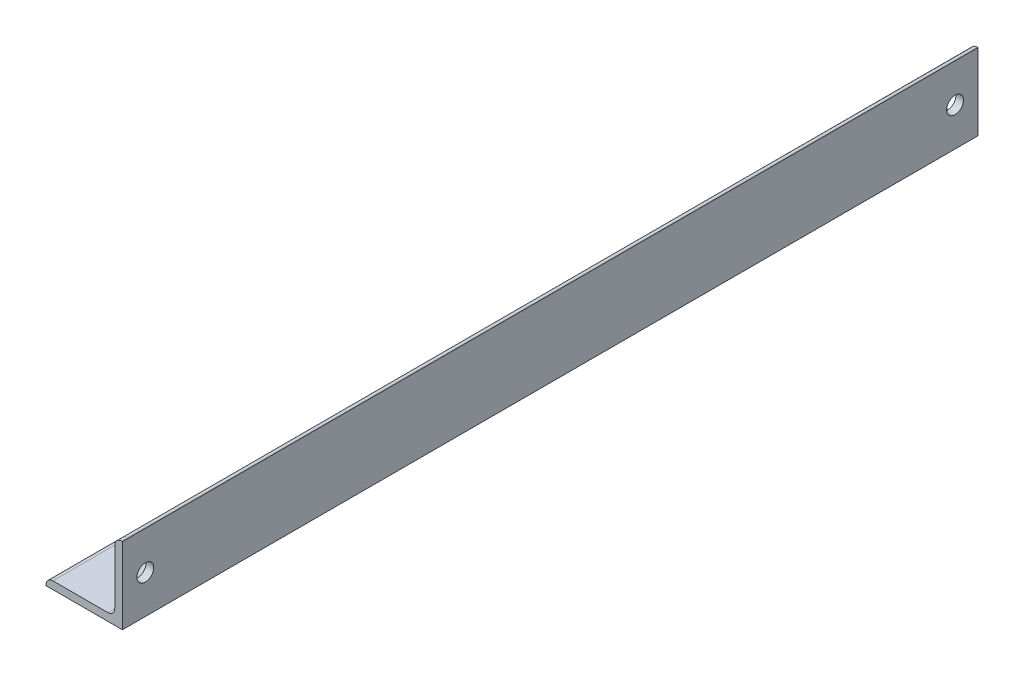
SolidWorks part; units mm, degrees
ref_plane "Face" through (0, 0, 0) normal (0, 0, 1) x (1, 0, 0)
ref_plane "Dessus" through (0, 0, 0) normal (0, 1, 0) x (1, 0, 0)
ref_plane "Droite" through (0, 0, 0) normal (1, 0, 0) x (0, 0, -1)
sketch "Esquisse1" plane through (0, 0, 0) normal (0, 0, 1) x (1, 0, 0)
  line L0 (0, 0) -> (0, 50)
  line L1 (0, 0) -> (-50, 0)
  line L2 (-9.5, 5) -> (-45.5, 5)
  line L3 (-5, 9.5) -> (-5, 45.5)
  line L4 (0, 50) -> (-0.5, 50)
  line L5 (-50, 0) -> (-50, 0.5)
  arc A0 (-45.5, 5) -> (-50, 0.5) centre (-45.5, 0.5) ccw
  arc A1 (-9.5, 5) -> (-5, 9.5) centre (-9.5, 9.5) ccw
  arc A2 (-0.5, 50) -> (-5, 45.5) centre (-0.5, 45.5) ccw
  dimension "D5" = 4.5
  dimension "D1" = 50
  dimension "D2" = 50
  dimension "D3" = 5
  dimension "D4" = 5
extrude "Base-Extrusion" add sketch "Esquisse1" along normal blind 560
sketch "Esquisse2" plane through (0, 0, 0) normal (1, 0, 0) x (0, 0, -1)
  line L0 (-560, 0) -> (-560, 50) construction
  line L1 (0, 0) -> (0, 50) construction
  line L2 (-560, 0) -> (0, 0) construction
  circle A0 centre (-545, 25) radius 5.5
  circle A1 centre (-15, 25) radius 5.5
  dimension "D1" = 11
  dimension "D2" = 15
  dimension "D3" = 15
  dimension "D4" = 25
extrude "Enlèv. mat.-Extru.1" cut sketch "Esquisse2" against normal through all
